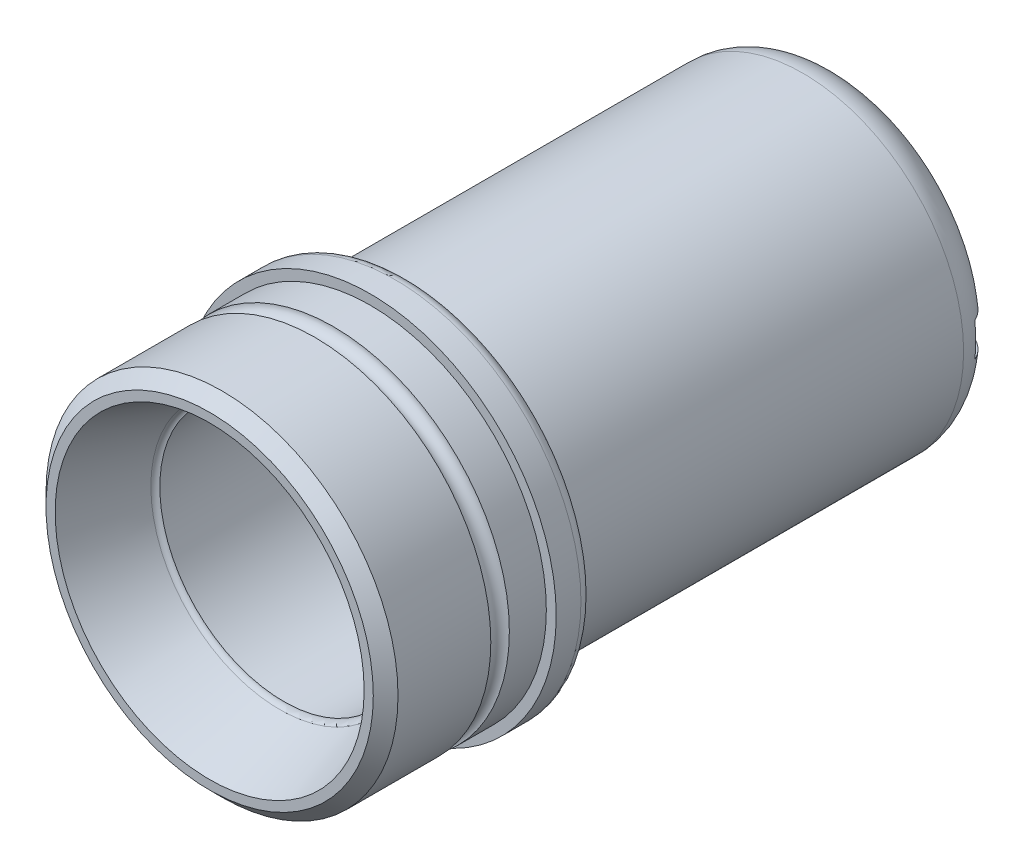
SolidWorks part; units mm, degrees
ref_plane "Спереди" through (0, 0, 0) normal (0, 0, 1) x (1, 0, 0)
ref_plane "Сверху" through (0, 0, 0) normal (0, 1, 0) x (1, 0, 0)
ref_plane "Справа" through (0, 0, 0) normal (1, 0, 0) x (0, 0, -1)
sketch "Эскиз1" plane through (0, 0, 0) normal (1, 0, 0) x (0, 0, -1)
  line L0 (0, 0) -> (111.5382, 0) construction
  line L1 (0, 19.8438) -> (0, 21.0185)
  line L2 (1.5875, 22.606) -> (13.5065, 22.606)
  line L3 (0, 19.8438) -> (9.01, 16.5644)
  line L4 (9.525, 15.9258) -> (25.4, 15.9258)
  line L5 (25.4, 15.9258) -> (27.2542, 17.78)
  line L6 (27.2542, 17.78) -> (61.3664, 17.78)
  line L7 (61.3664, 17.78) -> (76.3684, 9.1186)
  line L8 (76.3684, 9.1186) -> (80.9625, 9.1186)
  line L9 (80.9625, 9.1186) -> (80.9625, 15.875)
  line L10 (76.2, 20.6375) -> (26.1938, 20.6375)
  line L11 (25.4, 21.4312) -> (25.4, 22.2885)
  line L12 (23.8125, 23.876) -> (20.6375, 23.876)
  line L13 (20.6375, 23.876) -> (20.6375, 22.606)
  line L14 (20.6375, 22.606) -> (15.8877, 22.606)
  line L15 (0, 21.0185) -> (1.5875, 22.606)
  arc A0 (13.5065, 22.606) -> (15.8877, 22.606) centre (14.6971, 22.622) ccw
  arc A1 (9.01, 16.5644) -> (9.525, 15.9258) centre (8.7385, 15.8185) cw
  arc A2 (80.9625, 15.875) -> (76.2, 20.6375) centre (76.2, 15.875) ccw
  arc A3 (25.4, 22.2885) -> (23.8125, 23.876) centre (23.8125, 22.2885) ccw
  arc A4 (26.1938, 20.6375) -> (25.4, 21.4312) centre (26.1937, 21.4312) cw
  point P4 (0, 22.606)
  point P11 (14.6971, 21.4312)
  dimension "D7" = 0.7937
  dimension "D21" = 4.7625
  dimension "D22" = 1.5875
  dimension "D23" = 0.7937
  dimension "D1" = 45.212
  dimension "D2" = 18.2372
  dimension "D3" = 35.56
  dimension "D4" = 31.8516
  dimension "D5" = 9.525
  dimension "D6" = 39.6875
  dimension "D8" = 20
  dimension "D9" = 25.4
  dimension "D10" = 45
  dimension "D11" = 30
  dimension "D12" = 80.9625
  dimension "D13" = 61.3664
  dimension "D14" = 25.4
  dimension "D15" = 42.8625
  dimension "D16" = 20.6375
  dimension "D17" = 2.3813
  dimension "D18" = 4.7498
  dimension "D19" = 41.275
  dimension "D20" = 47.752
revolve "Повернуть1" add sketch "Эскиз1" angle 360 about L0
sketch "Эскиз2" plane through (0, 0, 0) normal (1, 0, 0) x (0, 0, -1)
  line L0 (0, 0) -> (80.9625, 0) construction
  line L1 (80.9625, -9.1186) -> (80.9625, 9.1186) construction
  line L2 (80.9625, 2.1828) -> (78.1844, 2.1828)
  line L3 (80.9625, 2.1828) -> (80.9625, -2.1828)
  line L4 (80.9625, -2.1828) -> (78.1844, -2.1828)
  line L5 (78.1844, 2.1828) -> (78.1844, -2.1828)
  dimension "D1" = 2.7781
  dimension "D2" = 4.3656
extrude "Вырез-Вытянуть1" cut sketch "Эскиз2" against normal mid plane 48.26
sketch "Эскиз3" plane through (0, 0, 0) normal (0, 1, 0) x (0, 0, -1)
  line L0 (20.6375, 16.7188) -> (20.6375, 30.0534) construction
  line L2 (20.6375, 23.876) -> (22.225, 23.876)
  line L3 (20.6375, 23.876) -> (20.6375, 21.4947)
  line L4 (20.6375, 21.4947) -> (22.225, 21.4947)
  line L5 (22.225, 23.876) -> (22.225, 21.4947)
  line L6 (23.8125, 23.876) -> (20.6375, 23.876) construction
  dimension "D1" = 3.175
  dimension "D2" = 2.3813
  dimension "D3" = 20.6375
revolve "Вырез-Повернуть1" cut sketch "Эскиз3" angle 360 about L0
